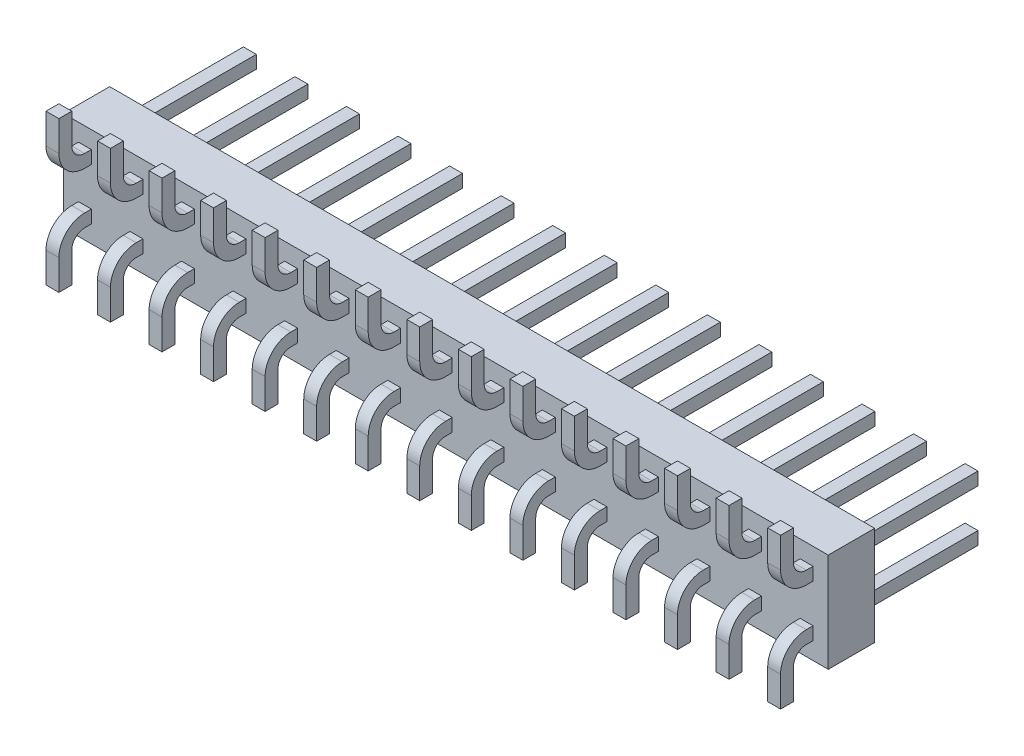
SolidWorks part; units mm, degrees
ref_plane "Front Plane" through (0, 0, 0) normal (0, 0, 1) x (1, 0, 0)
ref_plane "Top Plane" through (0, 0, 0) normal (0, 1, 0) x (1, 0, 0)
ref_plane "Right Plane" through (0, 0, 0) normal (1, 0, 0) x (0, 0, -1)
sketch "Sketch1" plane through (0, 0, 0) normal (0, 0, 1) x (1, 0, 0)
  line L0 (-7.9375, 1.5875) -> (-7.3025, 1.5875)
  line L1 (-18.8468, 2.4384) -> (18.8468, 2.4384)
  line L2 (-18.8468, 2.4384) -> (-18.8468, -2.4384)
  line L3 (-18.8468, -2.4384) -> (18.8468, -2.4384)
  line L4 (18.8468, 2.4384) -> (18.8468, -2.4384)
  line L5 (-18.0975, 1.5875) -> (-17.4625, 1.5875)
  line L6 (-18.0975, 1.5875) -> (-18.0975, 0.9525)
  line L7 (-18.0975, 0.9525) -> (-17.4625, 0.9525)
  line L8 (-17.4625, 1.5875) -> (-17.4625, 0.9525)
  line L9 (-18.0975, -0.9525) -> (-17.4625, -0.9525)
  line L10 (-18.0975, -0.9525) -> (-18.0975, -1.5875)
  line L11 (-18.0975, -1.5875) -> (-17.4625, -1.5875)
  line L12 (-17.4625, -0.9525) -> (-17.4625, -1.5875)
  line L13 (-15.5575, 1.5875) -> (-14.9225, 1.5875)
  line L14 (-15.5575, 1.5875) -> (-15.5575, 0.9525)
  line L15 (-15.5575, 0.9525) -> (-14.9225, 0.9525)
  line L16 (-14.9225, 1.5875) -> (-14.9225, 0.9525)
  line L17 (-15.5575, -0.9525) -> (-14.9225, -0.9525)
  line L18 (-15.5575, -0.9525) -> (-15.5575, -1.5875)
  line L19 (-15.5575, -1.5875) -> (-14.9225, -1.5875)
  line L20 (-14.9225, -0.9525) -> (-14.9225, -1.5875)
  line L21 (-13.0175, 1.5875) -> (-12.3825, 1.5875)
  line L22 (-13.0175, 1.5875) -> (-13.0175, 0.9525)
  line L23 (-13.0175, 0.9525) -> (-12.3825, 0.9525)
  line L24 (-12.3825, 1.5875) -> (-12.3825, 0.9525)
  line L25 (-13.0175, -0.9525) -> (-12.3825, -0.9525)
  line L26 (-13.0175, -0.9525) -> (-13.0175, -1.5875)
  line L27 (-13.0175, -1.5875) -> (-12.3825, -1.5875)
  line L28 (-12.3825, -0.9525) -> (-12.3825, -1.5875)
  line L29 (-10.4775, -1.5875) -> (-9.8425, -1.5875)
  line L30 (-10.4775, -1.5875) -> (-10.4775, -0.9525)
  line L31 (-10.4775, -0.9525) -> (-9.8425, -0.9525)
  line L32 (-9.8425, -1.5875) -> (-9.8425, -0.9525)
  line L33 (-9.8425, 0.9525) -> (-10.4775, 0.9525)
  line L34 (-9.8425, 0.9525) -> (-9.8425, 1.5875)
  line L35 (-9.8425, 1.5875) -> (-10.4775, 1.5875)
  line L36 (-10.4775, 0.9525) -> (-10.4775, 1.5875)
  line L37 (-7.9375, 1.5875) -> (-7.9375, 0.9525)
  line L38 (-7.9375, 0.9525) -> (-7.3025, 0.9525)
  line L39 (-7.3025, 1.5875) -> (-7.3025, 0.9525)
  line L40 (-7.9375, -0.9525) -> (-7.3025, -0.9525)
  line L41 (-7.9375, -0.9525) -> (-7.9375, -1.5875)
  line L42 (-7.9375, -1.5875) -> (-7.3025, -1.5875)
  line L43 (-7.3025, -0.9525) -> (-7.3025, -1.5875)
  line L44 (-5.3975, 1.5875) -> (-4.7625, 1.5875)
  line L45 (-5.3975, 1.5875) -> (-5.3975, 0.9525)
  line L46 (-5.3975, 0.9525) -> (-4.7625, 0.9525)
  line L47 (-4.7625, 1.5875) -> (-4.7625, 0.9525)
  line L48 (-5.3975, -0.9525) -> (-4.7625, -0.9525)
  line L49 (-5.3975, -0.9525) -> (-5.3975, -1.5875)
  line L50 (-5.3975, -1.5875) -> (-4.7625, -1.5875)
  line L51 (-4.7625, -0.9525) -> (-4.7625, -1.5875)
  line L52 (-2.8575, 1.5875) -> (-2.2225, 1.5875)
  line L53 (-2.8575, 1.5875) -> (-2.8575, 0.9525)
  line L54 (-2.8575, 0.9525) -> (-2.2225, 0.9525)
  line L55 (-2.2225, 1.5875) -> (-2.2225, 0.9525)
  line L56 (-2.8575, -0.9525) -> (-2.2225, -0.9525)
  line L57 (-2.8575, -0.9525) -> (-2.8575, -1.5875)
  line L58 (-2.8575, -1.5875) -> (-2.2225, -1.5875)
  line L59 (-2.2225, -0.9525) -> (-2.2225, -1.5875)
  line L60 (-0.3175, -1.5875) -> (0.3175, -1.5875)
  line L61 (-0.3175, -1.5875) -> (-0.3175, -0.9525)
  line L62 (-0.3175, -0.9525) -> (0.3175, -0.9525)
  line L63 (0.3175, -1.5875) -> (0.3175, -0.9525)
  line L64 (0.3175, 0.9525) -> (-0.3175, 0.9525)
  line L65 (0.3175, 0.9525) -> (0.3175, 1.5875)
  line L66 (0.3175, 1.5875) -> (-0.3175, 1.5875)
  line L67 (-0.3175, 0.9525) -> (-0.3175, 1.5875)
  line L68 (2.2225, 1.5875) -> (2.8575, 1.5875)
  line L69 (2.2225, 1.5875) -> (2.2225, 0.9525)
  line L70 (2.2225, 0.9525) -> (2.8575, 0.9525)
  line L71 (2.8575, 1.5875) -> (2.8575, 0.9525)
  line L72 (2.2225, -0.9525) -> (2.8575, -0.9525)
  line L73 (2.2225, -0.9525) -> (2.2225, -1.5875)
  line L74 (2.2225, -1.5875) -> (2.8575, -1.5875)
  line L75 (2.8575, -0.9525) -> (2.8575, -1.5875)
  line L76 (4.7625, 1.5875) -> (5.3975, 1.5875)
  line L77 (4.7625, 1.5875) -> (4.7625, 0.9525)
  line L78 (4.7625, 0.9525) -> (5.3975, 0.9525)
  line L79 (5.3975, 1.5875) -> (5.3975, 0.9525)
  line L80 (4.7625, -0.9525) -> (5.3975, -0.9525)
  line L81 (4.7625, -0.9525) -> (4.7625, -1.5875)
  line L82 (4.7625, -1.5875) -> (5.3975, -1.5875)
  line L83 (5.3975, -0.9525) -> (5.3975, -1.5875)
  line L84 (7.3025, 1.5875) -> (7.9375, 1.5875)
  line L85 (7.3025, 1.5875) -> (7.3025, 0.9525)
  line L86 (7.3025, 0.9525) -> (7.9375, 0.9525)
  line L87 (7.9375, 1.5875) -> (7.9375, 0.9525)
  line L88 (7.3025, -0.9525) -> (7.9375, -0.9525)
  line L89 (7.3025, -0.9525) -> (7.3025, -1.5875)
  line L90 (7.3025, -1.5875) -> (7.9375, -1.5875)
  line L91 (7.9375, -0.9525) -> (7.9375, -1.5875)
  line L92 (9.8425, -1.5875) -> (10.4775, -1.5875)
  line L93 (9.8425, -1.5875) -> (9.8425, -0.9525)
  line L94 (9.8425, -0.9525) -> (10.4775, -0.9525)
  line L95 (10.4775, -1.5875) -> (10.4775, -0.9525)
  line L96 (10.4775, 0.9525) -> (9.8425, 0.9525)
  line L97 (10.4775, 0.9525) -> (10.4775, 1.5875)
  line L98 (10.4775, 1.5875) -> (9.8425, 1.5875)
  line L99 (9.8425, 0.9525) -> (9.8425, 1.5875)
  line L100 (12.3826, 1.5875) -> (13.0176, 1.5875)
  line L101 (12.3826, 1.5875) -> (12.3826, 0.9525)
  line L102 (12.3826, 0.9525) -> (13.0176, 0.9525)
  line L103 (13.0176, 1.5875) -> (13.0176, 0.9525)
  line L104 (12.3826, -0.9525) -> (13.0176, -0.9525)
  line L105 (12.3826, -0.9525) -> (12.3826, -1.5875)
  line L106 (12.3826, -1.5875) -> (13.0176, -1.5875)
  line L107 (13.0176, -0.9525) -> (13.0176, -1.5875)
  line L108 (14.9226, 1.5875) -> (15.5576, 1.5875)
  line L109 (14.9226, 1.5875) -> (14.9226, 0.9525)
  line L110 (14.9226, 0.9525) -> (15.5576, 0.9525)
  line L111 (15.5576, 1.5875) -> (15.5576, 0.9525)
  line L112 (14.9226, -0.9525) -> (15.5576, -0.9525)
  line L113 (14.9226, -0.9525) -> (14.9226, -1.5875)
  line L114 (14.9226, -1.5875) -> (15.5576, -1.5875)
  line L115 (15.5576, -0.9525) -> (15.5576, -1.5875)
  line L116 (17.4626, 1.5875) -> (18.0976, 1.5875)
  line L117 (17.4626, 1.5875) -> (17.4626, 0.9525)
  line L118 (17.4626, 0.9525) -> (18.0976, 0.9525)
  line L119 (18.0976, 1.5875) -> (18.0976, 0.9525)
  line L120 (17.4626, -0.9525) -> (18.0976, -0.9525)
  line L121 (17.4626, -0.9525) -> (17.4626, -1.5875)
  line L122 (17.4626, -1.5875) -> (18.0976, -1.5875)
  line L123 (18.0976, -0.9525) -> (18.0976, -1.5875)
extrude "Boss-Extrude1" add sketch "Sketch1" along normal blind 2.286 contours L1 L4 L3 L2
sketch "Sketch2" plane through (17.4626, 0, 0) normal (1, 0, 0) x (0, 0, -1)
  line L0 (-3.8862, 3.7084) -> (-3.8862, 2.2225)
  line L1 (-2.6162, 0.9525) -> (5.842, 0.9525)
  line L2 (5.842, 0.9525) -> (5.842, 1.5875)
  line L3 (5.842, 1.5875) -> (-2.6162, 1.5875)
  line L4 (-3.2512, 2.2225) -> (-3.2512, 3.7084)
  line L5 (-3.2512, 3.7084) -> (-3.8862, 3.7084)
  line L6 (-2.286, 1.5875) -> (0, 1.5875) construction
  line L7 (0, -2.4384) -> (0, 2.4384) construction
  line L8 (7.0228, 0) -> (-6.9872, 0) construction
  line L9 (-3.2512, -3.7084) -> (-3.8862, -3.7084)
  line L10 (-3.2512, -2.2225) -> (-3.2512, -3.7084)
  line L11 (5.842, -1.5875) -> (-2.6162, -1.5875)
  line L12 (5.842, -0.9525) -> (5.842, -1.5875)
  line L13 (-2.6162, -0.9525) -> (5.842, -0.9525)
  line L14 (-3.8862, -3.7084) -> (-3.8862, -2.2225)
  arc A0 (-3.8862, 2.2225) -> (-2.6162, 0.9525) centre (-2.6162, 2.2225) ccw
  arc A1 (-2.6162, 1.5875) -> (-3.2512, 2.2225) centre (-2.6162, 2.2225) cw
  arc A2 (-2.6162, -1.5875) -> (-3.2512, -2.2225) centre (-2.6162, -2.2225) ccw
  arc A3 (-3.8862, -2.2225) -> (-2.6162, -0.9525) centre (-2.6162, -2.2225) cw
  dimension "D1" = 0
  dimension "D2" = 5.842
  dimension "D3" = 8.4582
  dimension "D4" = 0.635
  dimension "D5" = 1.27
extrude "Boss-Extrude2" add sketch "Sketch2" along normal blind 0.635 separate body
pattern_linear "LPattern1" count 15 spacing 2.54 along (-1, 0, 0) of "Boss-Extrude2"
